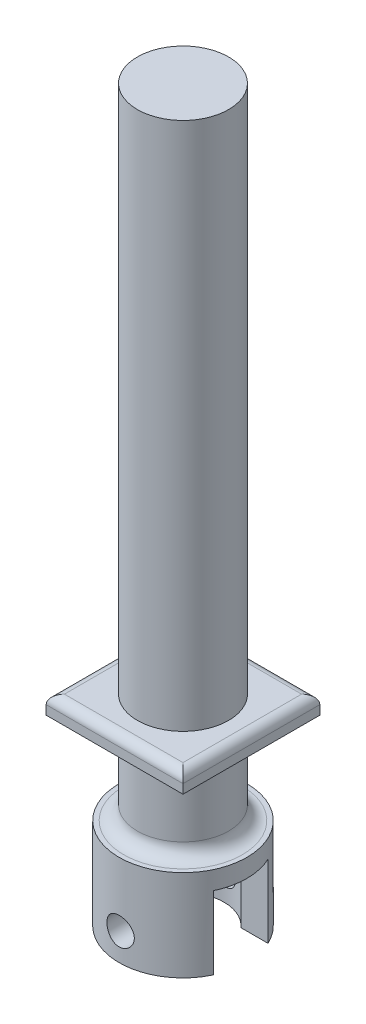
SolidWorks part; units mm, degrees
ref_plane "Front Plane" through (0, 0, 0) normal (0, 0, 1) x (1, 0, 0)
ref_plane "Top Plane" through (0, 0, 0) normal (0, 1, 0) x (1, 0, 0)
ref_plane "Right Plane" through (0, 0, 0) normal (1, 0, 0) x (0, 0, -1)
sketch "Sketch1" plane through (0, 0, 0) normal (0, 0, 1) x (1, 0, 0)
  line L0 (5, 86.145) -> (5, 16.145)
  line L1 (5, 86.145) -> (0, 86.145)
  line L2 (0, -55) -> (0, 55) construction
  line L3 (0, 86.145) -> (0, 16.145)
  line L4 (0, 16.145) -> (5, 16.145)
  dimension "D1" = 5
  dimension "D2" = 70
revolve "Revolve1" add sketch "Sketch1" angle 360 about L3
ref_plane "Plane1" through (0, 28.145, 0) normal (0, -1, 0) x (-1, 0, 0)
sketch "Sketch5" plane through (0, 28.145, 0) normal (0, -1, 0) x (-1, 0, 0)
  line L1 (-7.5, -7.5) -> (7.5, -7.5)
  line L2 (-7.5, -7.5) -> (-7.5, 7.5)
  line L3 (-7.5, 7.5) -> (7.5, 7.5)
  line L4 (7.5, -7.5) -> (7.5, 7.5)
  line L5 (-7.5, -7.5) -> (7.5, 7.5) construction
  line L6 (-7.5, 7.5) -> (7.5, -7.5) construction
  circle A0 centre (0, 0) radius 5 construction
  circle A1 centre (0, 0) radius 5
  point P0 (0, 0)
extrude "Boss-Extrude1" add sketch "Sketch5" along normal blind 2
sketch "Sketch6" plane through (0, 16.145, 0) normal (0, -1, 0) x (1, 0, 0)
  circle A1 centre (0, 0) radius 4.5
  arc A2 (-6.3246, -3) -> (6.3246, -3) centre (0, 0) ccw
  arc A6 (6.3246, -3) -> (-6.3246, -3) centre (0, 0) ccw
extrude "Boss-Extrude3" add sketch "Sketch6" along normal blind 10
fillet "Fillet6" radius 1.5 1 edges at (0, 16.145, -5)
sketch "Sketch7" plane through (0, 6.145, 0) normal (0, -1, 0) x (1, 0, 0)
  line L0 (55, 0) -> (-55, 0) construction
  line L1 (-10.9358, 3) -> (10.6217, 3)
  line L2 (-10.9358, 3) -> (-10.9358, -3)
  line L3 (-10.9358, -3) -> (10.6217, -3)
  line L4 (10.6217, 3) -> (10.6217, -3)
  dimension "D1" = 3
  dimension "D2" = 3
extrude "Cut-Extrude1" cut sketch "Sketch7" against normal blind 8
sketch "Sketch9" plane through (0, 0, 0) normal (0, 0, 1) x (1, 0, 0)
  line L0 (0, -55) -> (0, 55) construction
  line L1 (-6.3246, 6.145) -> (6.3246, 6.145) construction
  circle A0 centre (0, 9.145) radius 1.5
  dimension "D1" = 3
extrude "Cut-Extrude2" cut sketch "Sketch9" against normal through all both and the other way through all
fillet "Fillet7" radius 1 4 edges at (-7.5, 28.145, 0) (0, 28.145, -7.5) (7.5, 28.145, 0) (0, 28.145, 7.5)
